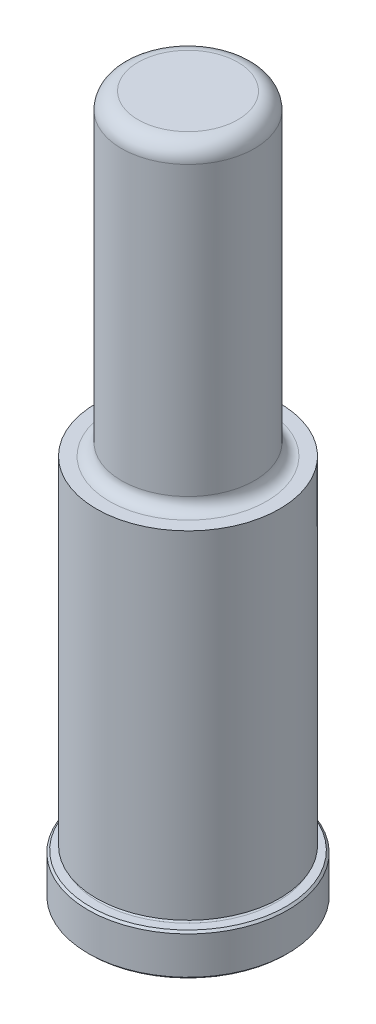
SolidWorks part; units mm, degrees
ref_plane "Front Plane" through (0, 0, 0) normal (0, 0, 1) x (1, 0, 0)
ref_plane "Top Plane" through (0, 0, 0) normal (0, 1, 0) x (1, 0, 0)
ref_plane "Right Plane" through (0, 0, 0) normal (1, 0, 0) x (0, 0, -1)
sketch "Sketch1" plane through (0, 0, 0) normal (1, 0, 0) x (0, 0, -1)
  line L0 (0, 0) -> (19.05, 0)
  line L1 (19.05, 0) -> (19.05, 7.9248)
  line L2 (19.05, 7.9248) -> (17.0688, 7.9248)
  line L3 (16.6878, 2.6782) -> (16.6878, 5.9795) construction
  line L4 (17.0688, 8.6868) -> (17.4752, 8.6868)
  line L5 (17.4752, 8.6868) -> (17.4752, 73.025)
  line L6 (17.4752, 73.025) -> (14.9733, 73.025)
  line L7 (12.6873, 75.311) -> (12.6873, 133.35)
  line L9 (12.6873, 133.35) -> (0, 133.35)
  line L10 (0, 133.35) -> (0, 0)
  line L11 (0, 0) -> (0, -7.2694) construction
  arc A0 (17.0688, 8.6868) -> (17.0688, 7.9248) centre (17.0688, 8.3058) ccw
  arc A1 (14.9733, 73.025) -> (12.6873, 75.311) centre (14.9733, 75.311) cw
  point P2 (12.6873, 133.35)
  point P14 (12.6873, 133.085)
  point P19 (12.6873, 73.025)
  dimension "D14" = 0.762
  dimension "D8" = 2.286
  dimension "T" = 7.9248
  dimension "D2" = 0.762
  dimension "M" = 38.1
  dimension "B" = 34.9504
  dimension "L" = 133.35
  dimension "D7" = 0.7874
  dimension "A" = 73.025
  dimension "D" = 25.3746
  dimension "D15" = 60.325
revolve "Revolve1" add sketch "Sketch1" angle 360 about L11
chamfer "Chamfer1" distance 0.381 angle 45 2 edges at (0, 0, 19.05) (0, 7.9248, 19.05)
fillet "Fillet7" radius 3.175 1 edges at (0, 133.35, 12.6873)
